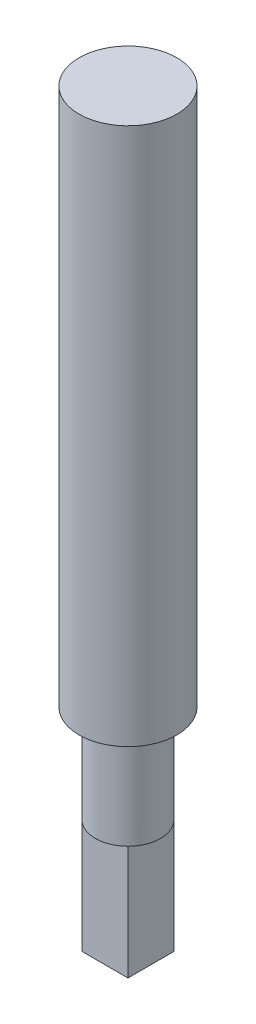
SolidWorks part; units mm, degrees
other "DetailItem3"
other "DetailItem4"
other "DetailItem5"
other "DetailItem6"
other "DetailItem7"
other "DetailItem8"
other "DetailItem9"
other "DetailItem10"
other "DetailItem11"
ref_plane "Front Plane" through (0, 0, 0) normal (0, 0, 1) x (1, 0, 0)
ref_plane "Top Plane" through (0, 0, 0) normal (0, 1, 0) x (1, 0, 0)
ref_plane "Right Plane" through (0, 0, 0) normal (1, 0, 0) x (0, 0, -1)
sketch "Sketch4" plane through (0, 0, 0) normal (1, 0, 0) x (0, 0, -1)
  line L0 (0, 0) -> (0, 3)
  line L1 (0, 3) -> (0, 4.5)
  line L2 (0, 4.5) -> (0, 6)
  line L3 (0, 6) -> (0, 7.5)
  line L4 (0, 7.5) -> (0, 9)
  line L5 (0, 9) -> (0, 10.5)
  line L6 (0, 10.5) -> (0, 12)
  line L7 (0, 12) -> (0, 13.5)
  line L8 (0, 13.5) -> (0, 16.5)
  line L9 (0, 16.5) -> (0, 19.5)
  line L10 (0, 19.5) -> (0, 21)
  line L11 (-1.5, 13.5) -> (1.5, 13.5)
  line L12 (-1.5, 19.5) -> (1.5, 19.5)
  line L13 (0, 21) -> (0, 22.5)
  line L14 (0, 22.5) -> (0, 24)
  line L15 (0, 24) -> (0, 27)
  line L16 (0, 0) -> (0, -3)
  line L17 (0, -3) -> (0, -4.5)
  line L18 (0, -4.5) -> (0, -6)
  line L19 (-1.5, -3) -> (1.5, -3)
  line L20 (-1.5, 3) -> (1.5, 3)
  dimension "D1" = 3
  dimension "D2" = 1.5
  dimension "D3" = 3
  dimension "D4" = 3
  dimension "D5" = 1.5
  dimension "D6" = 3
  dimension "D7" = 3
  dimension "D8" = 1.5
sketch "Sketch3" plane through (0, 0, 0) normal (0, 1, 0) x (1, 0, 0)
  circle A0 centre (1.5, 0) radius 1.5
  dimension "D1" = 3
extrude "Boss-Extrude2" add sketch "Sketch3" along normal up to vertex (16.5 mm away) contours A0
sketch "Sketch6" plane through (0, 0, 0) normal (1, 0, 0) x (0, 0, -1)
  line L1 (0, 9) -> (0, 10.5) construction
  line L2 (0.5, 4.5) -> (-0.5, 4.5)
  line L3 (0.5, 4.5) -> (0.5, 7.5)
  line L4 (0.5, 7.5) -> (-0.5, 7.5)
  line L5 (-0.5, 4.5) -> (-0.5, 7.5)
  line L6 (0.5, 4.5) -> (-0.5, 7.5) construction
  line L7 (0.5, 7.5) -> (-0.5, 4.5) construction
  point P0 (0, 6)
  dimension "D1" = 1
extrude "Cut-Extrude2" cut sketch "Sketch6" along normal blind 1
sketch "Sketch7" plane through (0, 0, 0) normal (0, -1, 0) x (1, 0, 0)
  circle A0 centre (1.5, 0) radius 1
  circle A1 centre (1.5, 0) radius 1.5 construction
  dimension "D1" = 2
extrude "Boss-Extrude3" add sketch "Sketch7" along normal blind 6.5
sketch "Sketch8" plane through (0, -6.5, 0) normal (0, -1, 0) x (1, 0, 0)
  line L1 (2.2071, -0.7071) -> (0.7929, -0.7071)
  line L2 (2.2071, -0.7071) -> (2.2071, 0.7071)
  line L3 (2.2071, 0.7071) -> (0.7929, 0.7071)
  line L4 (0.7929, -0.7071) -> (0.7929, 0.7071)
  line L5 (2.2071, -0.7071) -> (0.7929, 0.7071) construction
  line L6 (2.2071, 0.7071) -> (0.7929, -0.7071) construction
  circle A0 centre (1.5, 0) radius 1 construction
  circle A1 centre (1.5, 0) radius 1
  point P0 (1.5, 0)
extrude "Cut-Extrude3" cut sketch "Sketch8" against normal blind 3.5 contours L1 M1 | L4 M1 | L3 M1 | L2 M1
